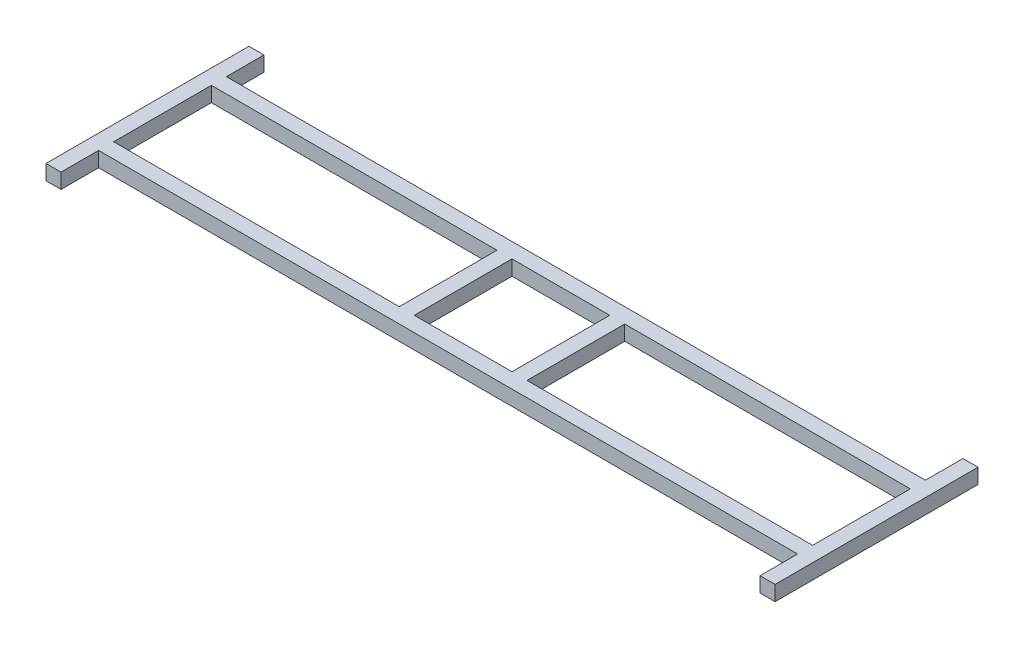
SolidWorks part; units mm, degrees
ref_plane "Front Plane" through (0, 0, 0) normal (0, 0, 1) x (1, 0, 0)
ref_plane "Top Plane" through (0, 0, 0) normal (0, 1, 0) x (1, 0, 0)
ref_plane "Right Plane" through (0, 0, 0) normal (1, 0, 0) x (0, 0, -1)
sketch "Sketch1" plane through (0, 0, 0) normal (0, 1, 0) x (1, 0, 0)
  line L0 (0, -150) -> (0, 150) construction
  line L1 (0, 150) -> (0, 270) construction
  line L2 (0, 150) -> (1900, 150) construction
  line L3 (1900, 150) -> (1900, 270) construction
  line L4 (1900, 150) -> (1900, -150) construction
  line L5 (800, 150) -> (800, -150) construction
  line L6 (1100, 150) -> (1100, -150) construction
  line L7 (0, 0) -> (800, 0) construction
  line L8 (1900, -150) -> (1900, -270) construction
  line L9 (0, -150) -> (1900, -150) construction
  line L10 (0, -150) -> (0, -270) construction
  line L11 (780, 130) -> (780, -130)
  line L12 (20, 130) -> (780, 130)
  line L13 (20, -130) -> (20, 130)
  line L14 (20, -170) -> (1880, -170)
  line L15 (-20, -150) -> (-20, -270)
  line L16 (20, 170) -> (20, 270)
  line L17 (1080, 130) -> (1080, -130)
  line L18 (1880, 130) -> (1880, -130)
  line L19 (1920, 150) -> (1920, 270)
  line L20 (1880, -170) -> (1880, -270)
  line L21 (820, 130) -> (820, -130)
  line L22 (20, 170) -> (1880, 170)
  line L23 (-20, -150) -> (-20, 150)
  line L24 (20, -130) -> (780, -130)
  line L25 (20, -170) -> (20, -270)
  line L26 (-20, 150) -> (-20, 270)
  line L27 (1120, 130) -> (1120, -130)
  line L28 (1920, 150) -> (1920, -150)
  line L29 (1880, 170) -> (1880, 270)
  line L30 (1920, -150) -> (1920, -270)
  line L31 (820, 130) -> (1080, 130)
  line L32 (0, 130) -> (1900, 130) construction
  line L33 (0, 170) -> (1900, 170) construction
  line L34 (0, -170) -> (1900, -170) construction
  line L35 (0, -130) -> (1900, -130) construction
  line L36 (20, -150) -> (20, 150) construction
  line L37 (20, -150) -> (20, -270) construction
  line L38 (20, 150) -> (20, 270) construction
  line L39 (780, 150) -> (780, -150) construction
  line L40 (820, 150) -> (820, -150) construction
  line L41 (820, -130) -> (1080, -130)
  line L42 (1120, -130) -> (1880, -130)
  line L43 (1080, 150) -> (1080, -150) construction
  line L44 (1120, 150) -> (1120, -150) construction
  line L45 (1120, 130) -> (1880, 130)
  line L46 (20, 270) -> (-20, 270)
  line L47 (1880, 150) -> (1880, -150) construction
  line L48 (1880, -150) -> (1880, -270) construction
  line L49 (1880, 150) -> (1880, 270) construction
  line L50 (20, -270) -> (-20, -270)
  line L51 (1880, 270) -> (1920, 270)
  line L52 (1920, -270) -> (1880, -270)
  point P14 (1100, 0)
  point P15 (1900, 0)
  dimension "D1" = 800
  dimension "D2" = 300
  dimension "D3" = 800
  dimension "D4" = 20
  dimension "D5" = 20
  dimension "D7" = 150
  dimension "D8" = 120
  dimension "D9" = 120
extrude "Boss-Extrude1" add sketch "Sketch1" along normal blind 40 contours L52 L30 L28 L19 L51 L29 L22 L16 L46 L26 L23 L15 L50 L25 L14 L20 L41 L21 L31 L17 L24 L13 L12 L11 L27 L45 L18 L42
scale "Scale1" scale about centroid uniform scaling yes scale factor 2.5
